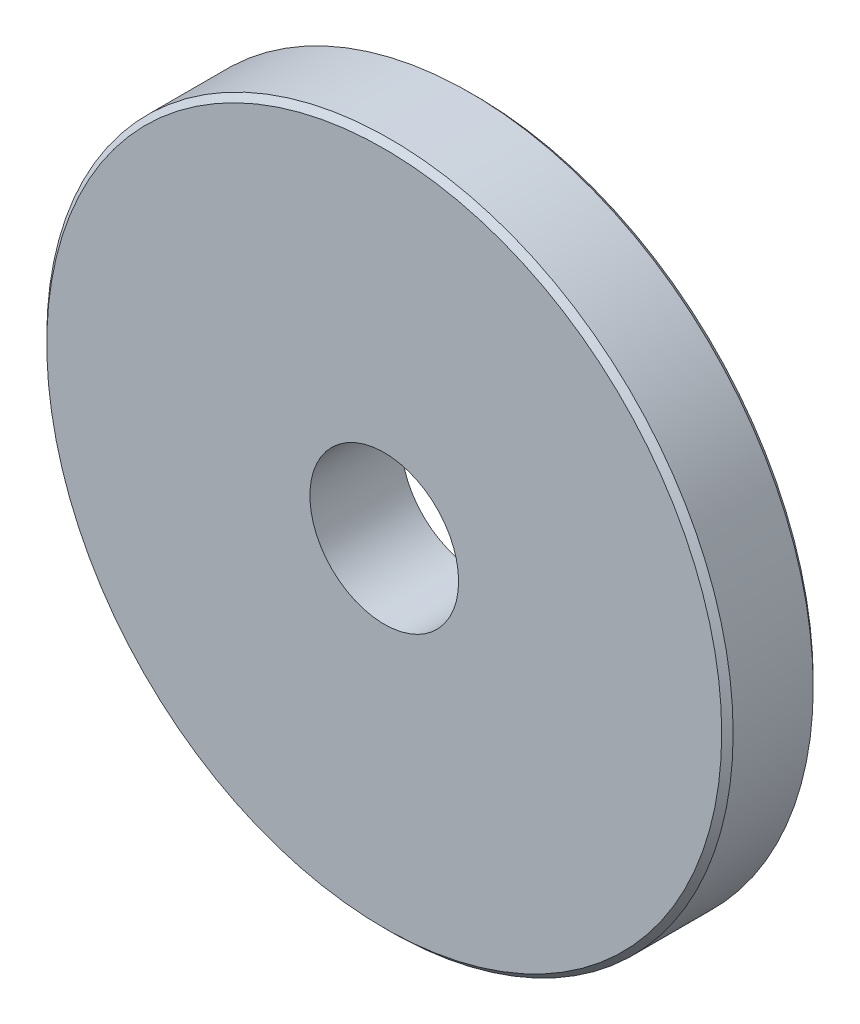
SolidWorks part; units mm, degrees
ref_plane "Plan de face" through (0, 0, 0) normal (0, 0, 1) x (1, 0, 0)
ref_plane "Plan de dessus" through (0, 0, 0) normal (0, 1, 0) x (1, 0, 0)
ref_plane "Plan de droite" through (0, 0, 0) normal (1, 0, 0) x (0, 0, -1)
sketch "Esquisse1" plane through (0, 0, 0) normal (0, 0, 1) x (1, 0, 0)
  circle A0 centre (0, 0) radius 6.5
  circle A1 centre (0, 0) radius 30
  dimension "D1" = 13
  dimension "D2" = 60
extrude "Extrusion1" add sketch "Esquisse1" along normal blind 8
chamfer "Chanfrein1" distance 0.5 angle 45 2 edges at (30, 0, 8) (30, 0, 0)
